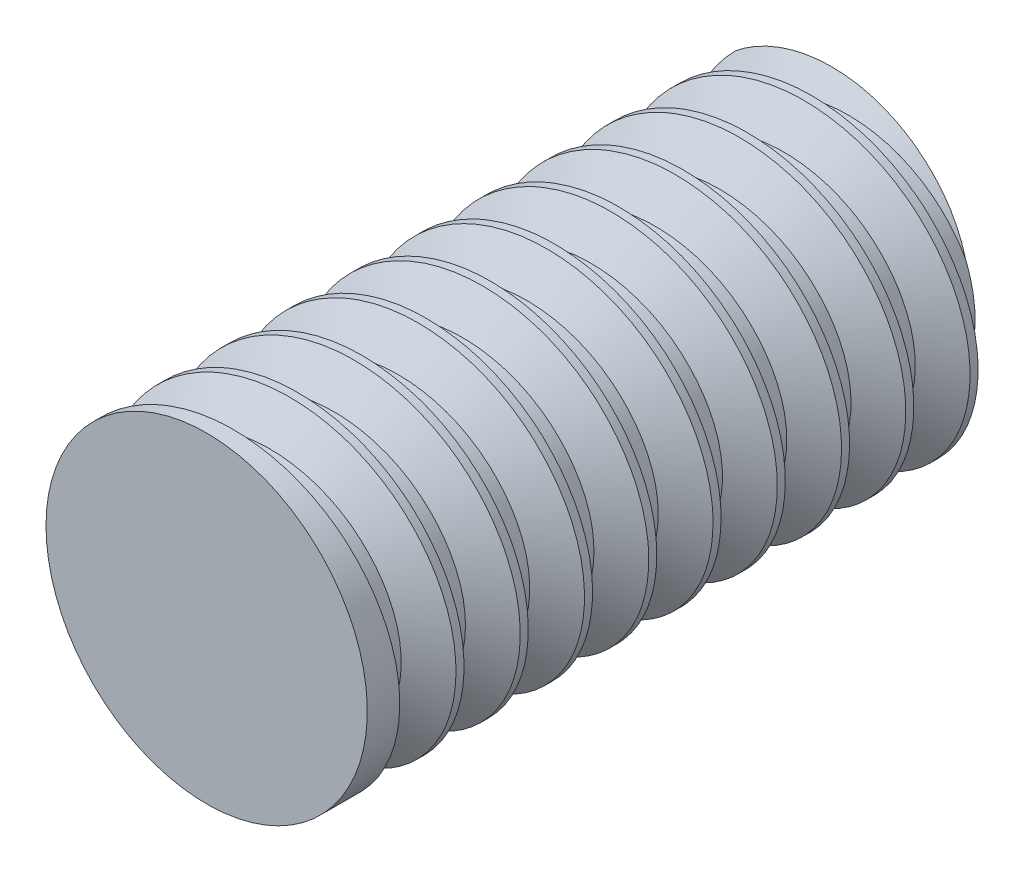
SolidWorks part; units mm, degrees
ref_plane "Front Plane" through (0, 0, 0) normal (0, 0, 1) x (1, 0, 0)
ref_plane "Top Plane" through (0, 0, 0) normal (0, 1, 0) x (1, 0, 0)
ref_plane "Right Plane" through (0, 0, 0) normal (1, 0, 0) x (0, 0, -1)
sketch "Sketch1" plane through (0, 0, 0) normal (0, 0, 1) x (1, 0, 0)
  circle A0 centre (0, 0) radius 3.175
  dimension "D1" = 6.35
extrude "Boss-Extrude1" add sketch "Sketch1" along normal mid plane 12.7
thread "Thread1" pitch 1.27 start angle 0, offset 0, length 12.7, pitch 1.27, diameter 6.35
ref_plane "Plane1" through (-3.175, 0, 6.35) normal (0, -1, 0) x (-1, 0, 0)
sketch "Thread Profile1" plane through (-3.175, 0, 6.35) normal (0, -1, 0) x (-1, 0, 0)
  line L0 (0, 0) -> (0, 1.27) construction
  line L11 (0, 0) -> (0, 1.1112)
  line L12 (0, 1.1112) -> (-0.6874, 0.7144)
  line L13 (-0.6874, 0.7144) -> (-0.6874, 0.3969)
  line L15 (-0.6874, 0.3969) -> (0, 0)
  line L17 (-0.6874, 0.5556) -> (0, 0.5556) construction
  point P2 (0, 0)
  dimension "Pitch" = 1.27
  dimension "Profile_Angle" = 60
  dimension "Profile_Land" = 0.3175
  dimension "Profile_Height" = 0.6874
